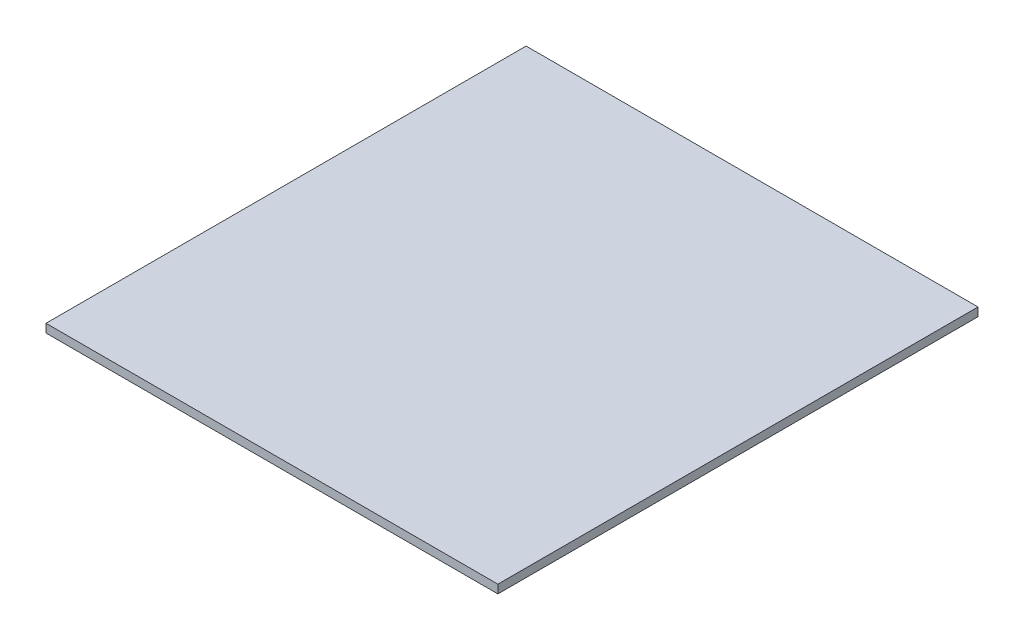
SolidWorks part; units mm, degrees
ref_plane "Front Plane" through (0, 0, 0) normal (0, 0, 1) x (1, 0, 0)
ref_plane "Top Plane" through (0, 0, 0) normal (0, 1, 0) x (1, 0, 0)
ref_plane "Right Plane" through (0, 0, 0) normal (1, 0, 0) x (0, 0, -1)
sketch "Sketch1" plane through (0, 0, 0) normal (0, 1, 0) x (1, 0, 0)
  line L1 (-320, -340) -> (320, -340)
  line L2 (-320, -340) -> (-320, 340)
  line L3 (-320, 340) -> (320, 340)
  line L4 (320, -340) -> (320, 340)
  line L5 (-320, -340) -> (320, 340) construction
  line L6 (-320, 340) -> (320, -340) construction
  point P0 (0, 0)
  point P5 (268.001, 310.7512)
  dimension "D1" = 680
  dimension "D2" = 640
extrude "Boss-Extrude1" add sketch "Sketch1" along normal blind 12
